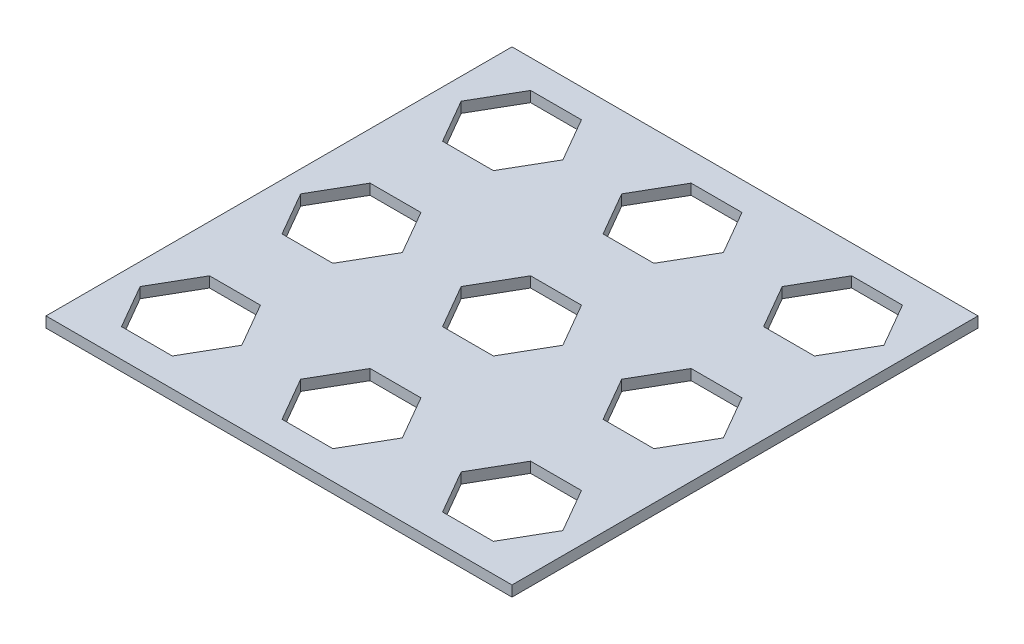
SolidWorks part; units mm, degrees
ref_plane "Front Plane" through (0, 0, 0) normal (0, 0, 1) x (1, 0, 0)
ref_plane "Top Plane" through (0, 0, 0) normal (0, 1, 0) x (1, 0, 0)
ref_plane "Right Plane" through (0, 0, 0) normal (1, 0, 0) x (0, 0, -1)
sketch "Sketch1" plane through (0, 0, 0) normal (0, 1, 0) x (1, 0, 0)
  line L1 (-34.925, -34.925) -> (34.925, -34.925)
  line L2 (-34.925, -34.925) -> (-34.925, 34.925)
  line L3 (-34.925, 34.925) -> (34.925, 34.925)
  line L4 (34.925, -34.925) -> (34.925, 34.925)
  line L5 (-34.925, -34.925) -> (34.925, 34.925) construction
  line L6 (-34.925, 34.925) -> (34.925, -34.925) construction
  line L7 (-20.2516, 30.6607) -> (-27.8716, 30.6607)
  line L8 (-27.8716, 30.6607) -> (-31.6816, 24.0616)
  line L9 (-31.6816, 24.0616) -> (-27.8716, 17.4625)
  line L10 (-27.8716, 17.4625) -> (-20.2516, 17.4625)
  line L11 (-20.2516, 17.4625) -> (-16.4416, 24.0616)
  line L12 (-16.4416, 24.0616) -> (-20.2516, 30.6607)
  line L60 (-34.925, 0) -> (34.925, 0) construction
  line L61 (0, 34.925) -> (0, -34.925) construction
  line L62 (-34.925, -17.4625) -> (34.925, -17.4625) construction
  line L63 (-34.925, 17.4625) -> (34.925, 17.4625) construction
  line L65 (-3.81, 17.4625) -> (3.81, 17.4625)
  line L66 (3.81, 17.4625) -> (7.62, 24.0616)
  line L67 (7.62, 24.0616) -> (3.81, 30.6607)
  line L68 (3.81, 30.6607) -> (-3.81, 30.6607)
  line L69 (-3.81, 30.6607) -> (-7.62, 24.0616)
  line L70 (-7.62, 24.0616) -> (-3.81, 17.4625)
  line L88 (20.2516, -17.4625) -> (16.4416, -24.0616)
  line L89 (16.4416, 24.0616) -> (20.2516, 30.6607)
  line L90 (20.2516, 17.4625) -> (16.4416, 24.0616)
  line L91 (27.8716, 17.4625) -> (20.2516, 17.4625)
  line L92 (31.6816, 24.0616) -> (27.8716, 17.4625)
  line L93 (27.8716, 30.6607) -> (31.6816, 24.0616)
  line L94 (20.2516, 30.6607) -> (27.8716, 30.6607)
  line L95 (27.8716, -17.4625) -> (20.2516, -17.4625)
  line L96 (31.6816, -24.0616) -> (27.8716, -17.4625)
  line L97 (27.8716, -30.6607) -> (31.6816, -24.0616)
  line L98 (20.2516, -30.6607) -> (27.8716, -30.6607)
  line L99 (16.4416, -24.0616) -> (20.2516, -30.6607)
  line L100 (-7.62, -24.0616) -> (-3.81, -17.4625)
  line L101 (-3.81, -30.6607) -> (-7.62, -24.0616)
  line L102 (3.81, -30.6607) -> (-3.81, -30.6607)
  line L103 (7.62, -24.0616) -> (3.81, -30.6607)
  line L104 (3.81, -17.4625) -> (7.62, -24.0616)
  line L105 (-3.81, -17.4625) -> (3.81, -17.4625)
  line L106 (-16.4416, -24.0616) -> (-20.2516, -30.6607)
  line L107 (-20.2516, -17.4625) -> (-16.4416, -24.0616)
  line L108 (-27.8716, -17.4625) -> (-20.2516, -17.4625)
  line L109 (-31.6816, -24.0616) -> (-27.8716, -17.4625)
  line L110 (-27.8716, -30.6607) -> (-31.6816, -24.0616)
  line L111 (-20.2516, -30.6607) -> (-27.8716, -30.6607)
  line L112 (-34.925, 12.0308) -> (34.925, 12.0308) construction
  line L113 (20.2516, 6.5991) -> (16.4416, 0)
  line L114 (27.8716, 6.5991) -> (20.2516, 6.5991)
  line L115 (31.6816, 0) -> (27.8716, 6.5991)
  line L116 (27.8716, -6.5991) -> (31.6816, 0)
  line L117 (20.2516, -6.5991) -> (27.8716, -6.5991)
  line L118 (16.4416, 0) -> (20.2516, -6.5991)
  line L119 (-7.62, 0) -> (-3.81, 6.5991)
  line L120 (-3.81, -6.5991) -> (-7.62, 0)
  line L121 (3.81, -6.5991) -> (-3.81, -6.5991)
  line L122 (7.62, 0) -> (3.81, -6.5991)
  line L123 (3.81, 6.5991) -> (7.62, 0)
  line L124 (-3.81, 6.5991) -> (3.81, 6.5991)
  line L125 (-16.4416, 0) -> (-20.2516, -6.5991)
  line L126 (-20.2516, 6.5991) -> (-16.4416, 0)
  line L127 (-27.8716, 6.5991) -> (-20.2516, 6.5991)
  line L128 (-31.6816, 0) -> (-27.8716, 6.5991)
  line L129 (-27.8716, -6.5991) -> (-31.6816, 0)
  line L130 (-20.2516, -6.5991) -> (-27.8716, -6.5991)
  circle A0 centre (-24.0616, 24.0616) radius 6.5991 construction
  circle A1 centre (0, 24.0616) radius 6.5991 construction
  point P0 (0, 0)
  dimension "D1" = 69.85
  dimension "D2" = 69.85
extrude "Boss-Extrude1" add sketch "Sketch1" along normal blind 1.5875
